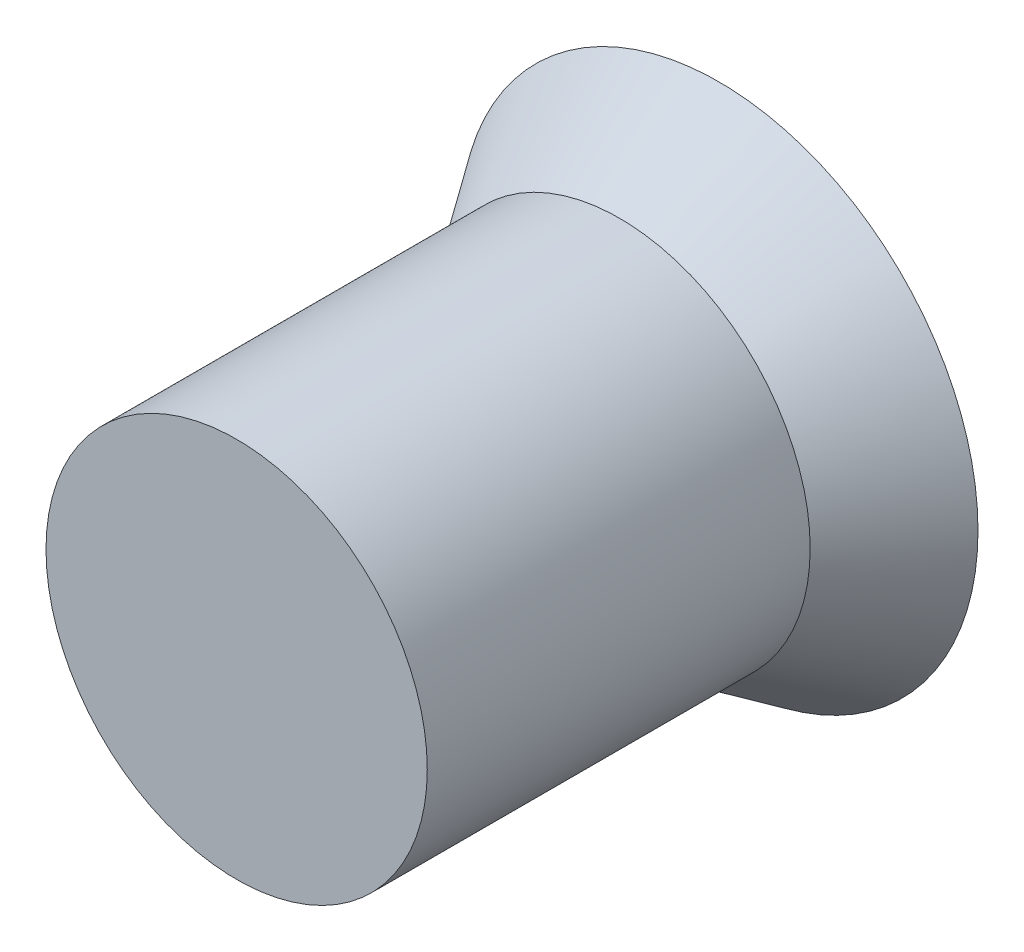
SolidWorks part; units mm, degrees
ref_plane "Front Plane" through (0, 0, 0) normal (0, 0, 1) x (1, 0, 0)
ref_plane "Top Plane" through (0, 0, 0) normal (0, 1, 0) x (1, 0, 0)
ref_plane "Right Plane" through (0, 0, 0) normal (1, 0, 0) x (0, 0, -1)
sketch "Sketch1" plane through (0, 0, 0) normal (0, 0, 1) x (1, 0, 0)
  circle A0 centre (0, 0) radius 1.17
  dimension "D1" = 2.34
extrude "Boss-Extrude1" add sketch "Sketch1" against normal blind 2.35
ref_plane "Plane1" through (0, 0, -2.96) normal (0, 0, -1) x (-1, 0, 0)
sketch "Sketch2" plane through (0, 0, -2.96) normal (0, 0, -1) x (-1, 0, 0)
  circle A0 centre (0, 0) radius 1.59
  dimension "D1" = 3.18
loft "Loft1" add profiles "Sketch2"
